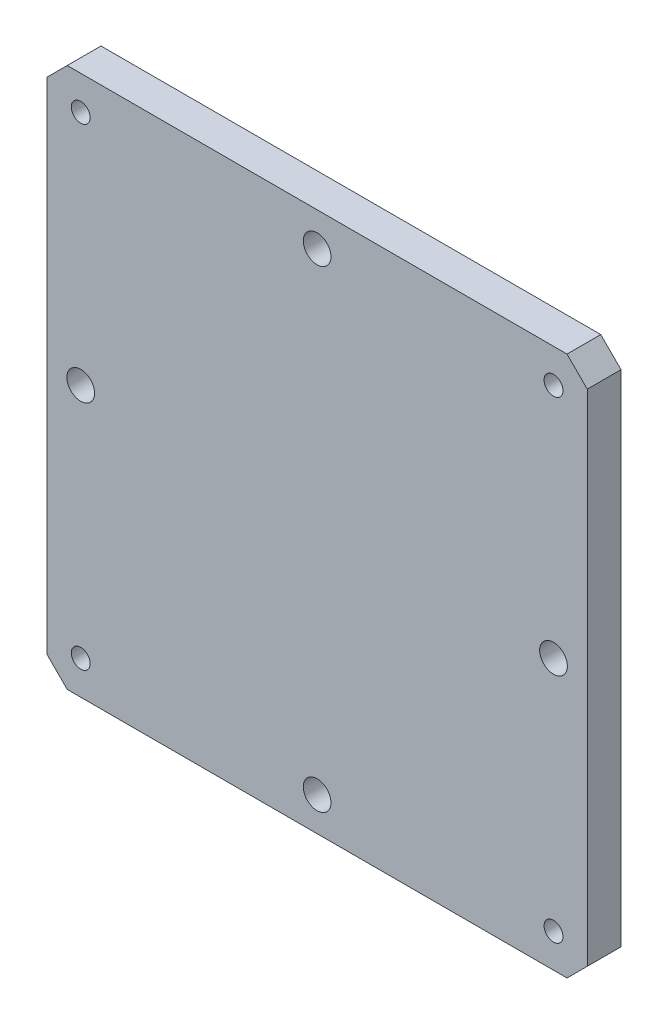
SolidWorks part; units mm, degrees
ref_plane "Спереди" through (0, 0, 0) normal (0, 0, 1) x (1, 0, 0)
ref_plane "Сверху" through (0, 0, 0) normal (0, 1, 0) x (1, 0, 0)
ref_plane "Справа" through (0, 0, 0) normal (1, 0, 0) x (0, 0, -1)
sketch "Эскиз1" plane through (0, 0, 0) normal (0, 0, 1) x (1, 0, 0)
  line L1 (0, 0) -> (400, 0)
  line L2 (0, 0) -> (0, 400)
  line L3 (0, 400) -> (400, 400)
  line L4 (400, 0) -> (400, 400)
  dimension "D1" = 400
  dimension "D2" = 400
extrude "Бобышка-Вытянуть1" add sketch "Эскиз1" along normal blind 25
hole_wizard "Отверстие обработанное метчиком M161" positions "Эскиз2" profile "Эскиз3" tap size "M16" standard "ISO"
sketch "Эскиз2" plane through (0, 0, 0) normal (0, 0, -1) x (-1, 0, 0)
  line L0 (-200, 400) -> (-200, 0) construction
  line L1 (-400, 400) -> (0, 400) construction
  line L2 (0, 0) -> (-400, 0) construction
  line L4 (-400, 200) -> (0, 200) construction
  line L5 (-400, 0) -> (-400, 400) construction
  line L6 (0, 400) -> (0, 0) construction
  point P0 (-375, 375)
  point P2 (-25, 375)
  point P4 (-25, 25)
  point P6 (-375, 25)
  dimension "D1" = 350
  dimension "D2" = 350
  dimension "D3" = 350
  dimension "D4" = 350
sketch "Эскиз3" plane through (375, 375, 0) normal (1, 0, 0) x (0, 1, 0)
  line L0 (0, 0) -> (0, 25)
  line L1 (0, 25) -> (7, 25)
  line L2 (7, 25) -> (7, 0)
  line L5 (7, 0) -> (0, 0)
  line L11 (0, -6.35) -> (0, 107.95) construction
  dimension "Диаметр проходного сверла" = 14
  dimension "Глубина проходного сверла" = 25
chamfer "Фаска1" distance 2 angle 45 4 edges at (368, 25, 0) (18, 25, 0) (18, 375, 0) (368, 375, 0)
sketch "Эскиз4" plane through (0, 0, 0) normal (0, 0, -1) x (-1, 0, 0)
  line L0 (-200, 400) -> (-200, 0) construction
  line L1 (-400, 400) -> (0, 400) construction
  line L2 (0, 0) -> (-400, 0) construction
  line L3 (-400, 200) -> (0, 200) construction
  line L4 (-400, 0) -> (-400, 400) construction
  line L5 (0, 400) -> (0, 0) construction
  circle A0 centre (-200, 375) radius 10.25
  circle A1 centre (-25, 200) radius 10.25
  circle A2 centre (-200, 25) radius 10.25
  circle A3 centre (-375, 200) radius 10.25
  dimension "D1" = 20.5
  dimension "D2" = 20.5
  dimension "D3" = 20.5
  dimension "D4" = 20.5
  dimension "D5" = 350
  dimension "D6" = 350
extrude "Вырез-Вытянуть1" cut sketch "Эскиз4" against normal through all
chamfer "Фаска2" distance 15 angle 45 4 edges at (400, 0, 12.5) (0, 0, 12.5) (400, 400, 12.5) (0, 400, 12.5)
